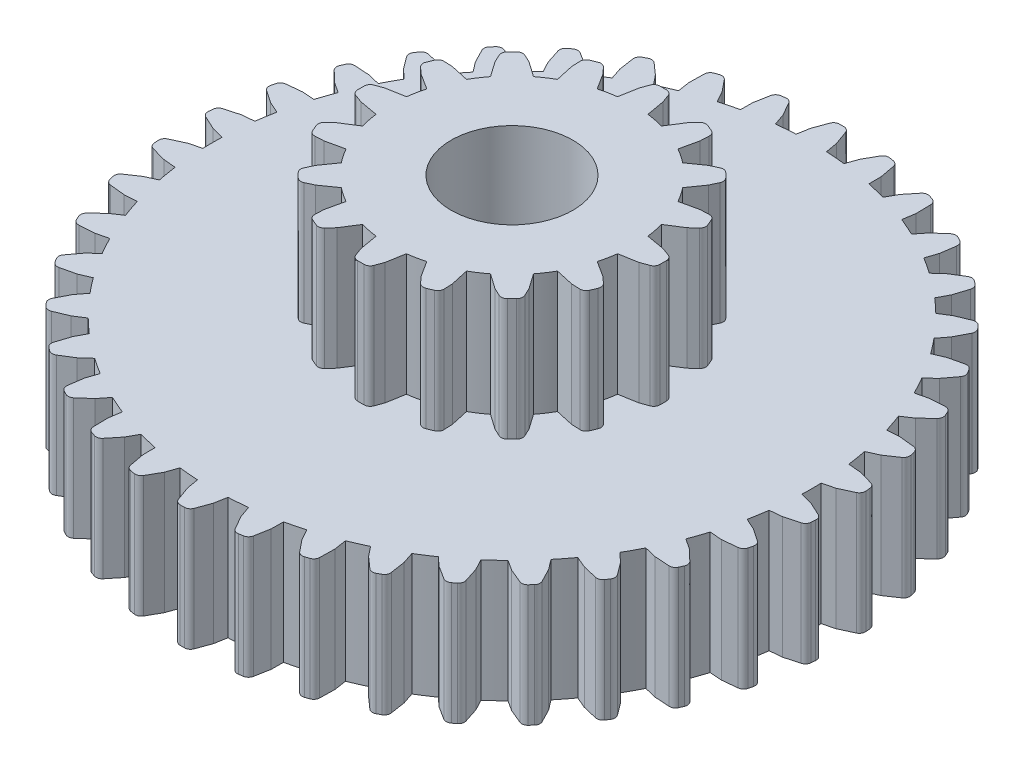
SolidWorks part; units mm, degrees
ref_plane "Front Plane" through (0, 0, 0) normal (0, 0, 1) x (1, 0, 0)
ref_plane "Top Plane" through (0, 0, 0) normal (0, 1, 0) x (1, 0, 0)
ref_plane "Right Plane" through (0, 0, 0) normal (1, 0, 0) x (0, 0, -1)
sketch "Sketch1" plane through (0, 0, 0) normal (0, 1, 0) x (1, 0, 0)
  circle A0 centre (0, 0) radius 62.5475
  circle A1 centre (0, 0) radius 12.7
  dimension "D1" = 25.4
  dimension "D2" = 125.095
extrude "Boss-Extrude1" add sketch "Sketch1" along normal blind 25.4
sketch "Sketch2" plane through (0, 25.4, 0) normal (0, 1, 0) x (1, 0, 0)
  line L0 (-3.175, 62.4669) -> (3.175, 62.4669)
  line L1 (3.175, 62.4669) -> (2.7271, 65.0069)
  line L2 (2.7271, 65.0069) -> (1.3404, 68.8169)
  line L3 (1.3404, 68.8169) -> (-1.3404, 68.8169)
  line L4 (-1.3404, 68.8169) -> (-2.7271, 65.0069)
  line L5 (-2.7271, 65.0069) -> (-3.175, 62.4669)
  circle A0 centre (0, 0) radius 62.5475 construction
  dimension "D1" = 80
  dimension "D2" = 110
  dimension "D3" = 6.35
  dimension "D4" = 2.54
  dimension "D5" = 3.81
extrude "Boss-Extrude2" add sketch "Sketch2" against normal blind 25.4
fillet "Fillet1" radius 1.27 2 edges at (1.3404, 12.7, -68.8169) (-1.3404, 12.7, -68.8169)
pattern_circular "CirPattern1" count 38 over 360 about axis through (0, 0, 0) along (0, 1, 0) of "Fillet1", "Boss-Extrude2"
sketch "Sketch3" plane through (0, 25.4, 0) normal (0, 1, 0) x (1, 0, 0)
  circle A0 centre (0, 0) radius 25.4
  circle A1 centre (0, 0) radius 12.7
  circle A2 centre (0, 0) radius 12.7 construction
  dimension "D1" = 50.8
extrude "Boss-Extrude3" add sketch "Sketch3" along normal blind 25.4
sketch "Sketch4" plane through (0, 50.8, 0) normal (0, 1, 0) x (1, 0, 0)
  line L0 (-3.175, 25.2008) -> (3.175, 25.2008)
  line L1 (3.175, 25.2008) -> (2.5032, 29.0108)
  line L2 (2.5032, 29.0108) -> (1.8829, 30.7151)
  line L3 (0.6894, 31.5508) -> (-0.6894, 31.5508)
  line L4 (-1.8829, 30.7151) -> (-2.5032, 29.0108)
  line L5 (-2.5032, 29.0108) -> (-3.175, 25.2008)
  circle A0 centre (0, 0) radius 25.4 construction
  arc A1 (0.6894, 31.5508) -> (1.8829, 30.7151) centre (0.6894, 30.2808) cw
  arc A2 (-0.6894, 31.5508) -> (-1.8829, 30.7151) centre (-0.6894, 30.2808) ccw
  point P11 (1.5787, 31.5508)
  dimension "D6" = 1.27
  dimension "D1" = 80
  dimension "D2" = 110
  dimension "D3" = 3.81
  dimension "D4" = 2.54
  dimension "D5" = 6.35
extrude "Boss-Extrude4" add sketch "Sketch4" against normal blind 25.4
pattern_circular "CirPattern2" count 16 over 360 about axis through (0, 0, 0) along (0, 1, 0) of "Boss-Extrude4"
